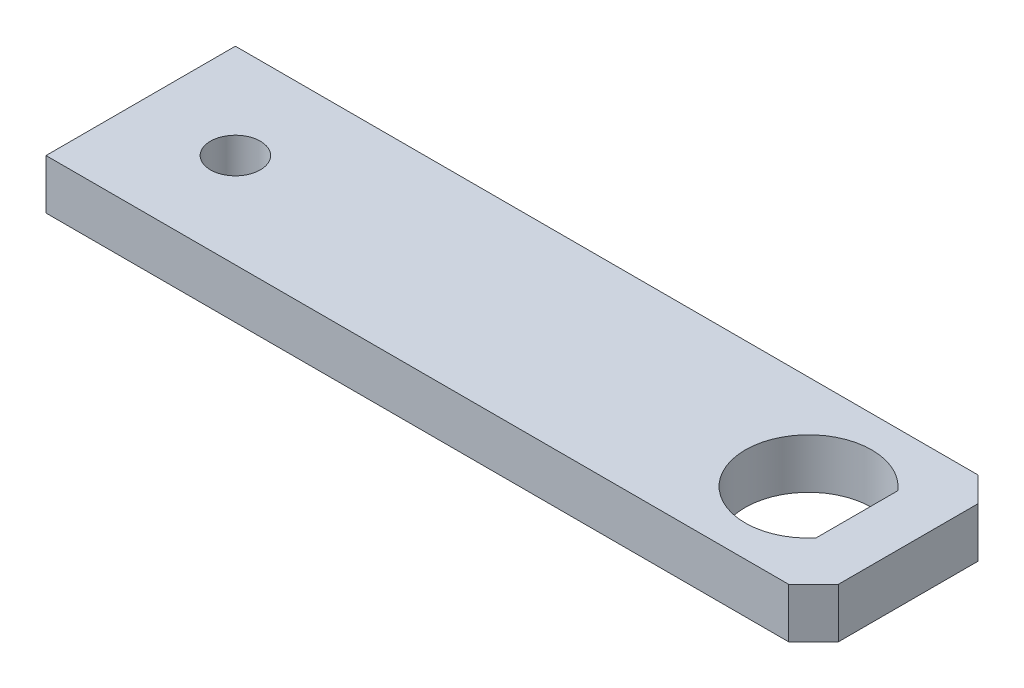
SolidWorks part; units mm, degrees
ref_plane "Ebene vorne" through (0, 0, 0) normal (0, 0, 1) x (1, 0, 0)
ref_plane "Ebene oben" through (0, 0, 0) normal (0, 1, 0) x (1, 0, 0)
ref_plane "Ebene rechts" through (0, 0, 0) normal (1, 0, 0) x (0, 0, -1)
ref_plane "Ebene1" through (0, 0, 0) normal (0, -1, 0) x (1, 0, 0)
sketch "Skizze1" plane through (0, 0, 0) normal (0, -1, 0) x (1, 0, 0)
  line L0 (71.85, 13.5988) -> (71.85, 5.4012)
  line L1 (77, 2.5) -> (77, 16.5)
  line L2 (77, 16.5) -> (74.5, 19)
  line L3 (74.5, 19) -> (0, 19)
  line L4 (0, 19) -> (0, 0)
  line L5 (0, 0) -> (74.5, 0)
  line L6 (74.5, 0) -> (77, 2.5)
  line L7 (0, 9.5) -> (85.3135, 9.5) construction
  circle A0 centre (9.5, 9.5) radius 2.5
  arc A1 (71.85, 5.4012) -> (71.85, 13.5988) centre (67, 9.5) cw
  dimension "D2" = 5
  dimension "D3" = 12.7
  dimension "D8" = 67
  dimension "D1" = 19
  dimension "D4" = 11.2
  dimension "D5" = 45
  dimension "D6" = 2.5
  dimension "D7" = 77
  dimension "D9" = 9.5
extrude "Linear austragen1" add sketch "Skizze1" against normal blind 5
